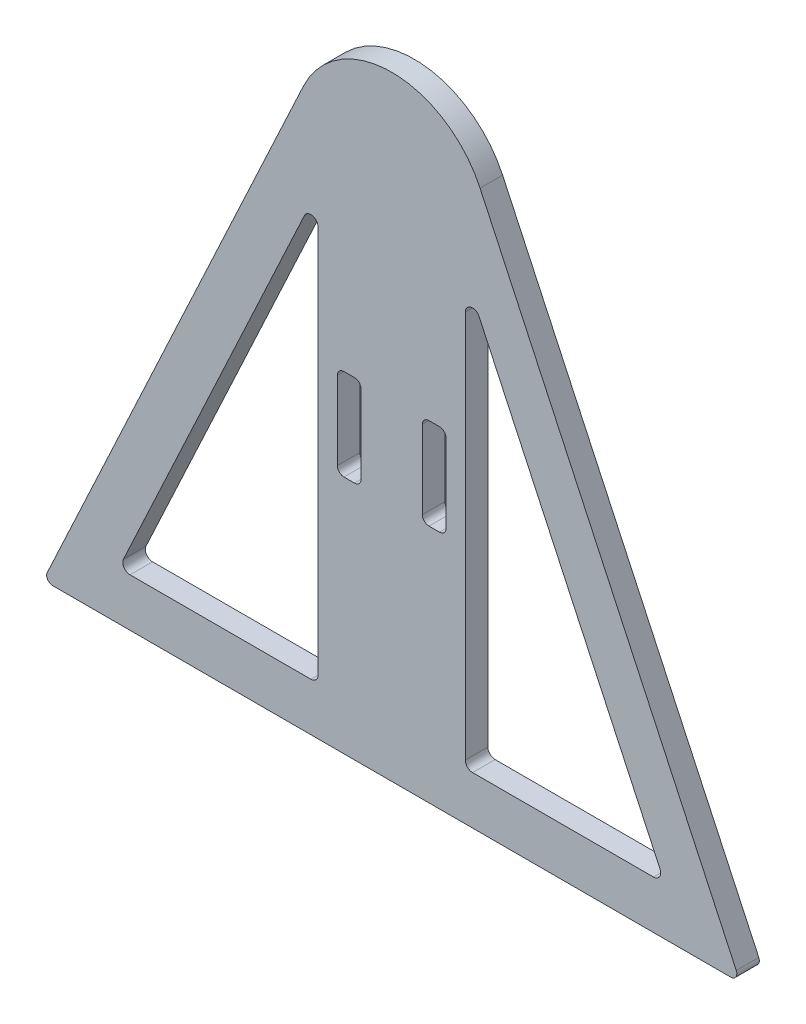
SolidWorks part; units mm, degrees
ref_plane "Front Plane" through (0, 0, 0) normal (0, 0, 1) x (1, 0, 0)
ref_plane "Top Plane" through (0, 0, 0) normal (0, 1, 0) x (1, 0, 0)
ref_plane "Right Plane" through (0, 0, 0) normal (1, 0, 0) x (0, 0, -1)
sketch "Sketch1" plane through (0, 0, 0) normal (0, 0, 1) x (1, 0, 0)
  line L0 (119.9869, 0) -> (-119.9463, 0) construction
  line L1 (73.66, 0) -> (-73.66, 0)
  line L2 (-73.66, 0) -> (-18.6702, 117.926)
  line L3 (0, 278.6164) -> (0, -84.0002) construction
  line L4 (73.66, 0) -> (18.6702, 117.926)
  arc A0 (-18.6702, 117.926) -> (18.6702, 117.926) centre (0, 109.22) cw
  dimension "D1" = 25
  dimension "D2" = 147.32
  dimension "D3" = 109.22
extrude "Extrude1" add sketch "Sketch1" along normal blind 4.7625
sketch "Sketch2" plane through (0, 0, 4.7625) normal (0, 0, 1) x (1, 0, 0)
  line L4 (0, -29.3485) -> (0, 294.747) construction
  line L5 (-11.4935, 52.07) -> (-11.4935, 68.58)
  line L6 (-10.0965, 69.977) -> (-7.874, 69.977)
  line L7 (-7.874, 50.673) -> (-10.0965, 50.673)
  line L8 (6.477, 68.58) -> (6.477, 52.07)
  line L9 (7.874, 50.673) -> (10.0965, 50.673)
  line L10 (10.0965, 69.977) -> (7.874, 69.977)
  line L11 (11.4935, 52.07) -> (11.4935, 68.58)
  line L12 (6.477, 68.58) -> (6.477, 52.07)
  line L13 (7.874, 50.673) -> (10.0965, 50.673)
  line L14 (10.0965, 69.977) -> (7.874, 69.977)
  line L15 (11.4935, 52.07) -> (11.4935, 68.58)
  line L16 (-6.477, 68.58) -> (-6.477, 52.07)
  arc A4 (-11.4935, 68.58) -> (-10.0965, 69.977) centre (-10.0965, 68.58) cw
  arc A5 (-7.874, 69.977) -> (-6.477, 68.58) centre (-7.874, 68.58) cw
  arc A6 (-10.0965, 50.673) -> (-11.4935, 52.07) centre (-10.0965, 52.07) cw
  arc A7 (-6.477, 52.07) -> (-7.874, 50.673) centre (-7.874, 52.07) cw
  arc A8 (6.477, 52.07) -> (7.874, 50.673) centre (7.874, 52.07) ccw
  arc A9 (10.0965, 50.673) -> (11.4935, 52.07) centre (10.0965, 52.07) ccw
  arc A10 (7.874, 69.977) -> (6.477, 68.58) centre (7.874, 68.58) ccw
  arc A11 (11.4935, 68.58) -> (10.0965, 69.977) centre (10.0965, 68.58) ccw
  arc A12 (6.477, 52.07) -> (7.874, 50.673) centre (7.874, 52.07) ccw
  arc A13 (10.0965, 50.673) -> (11.4935, 52.07) centre (10.0965, 52.07) ccw
  arc A14 (7.874, 69.977) -> (6.477, 68.58) centre (7.874, 68.58) ccw
  arc A15 (11.4935, 68.58) -> (10.0965, 69.977) centre (10.0965, 68.58) ccw
  dimension "D1" = 0.127
extrude "Cut-Extrude1" cut sketch "Sketch2" against normal through all
fillet "Fillet1" radius 1.27 2 edges at (-73.66, 0, 2.3813) (73.66, 0, 2.3813)
sketch "Sketch3" plane through (0, 0, 4.7625) normal (0, 0, 1) x (1, 0, 0)
  line L0 (15.5575, 93.6863) -> (15.5575, 11.684)
  line L1 (17.0815, 10.16) -> (55.3198, 10.16)
  line L2 (56.701, 12.3281) -> (18.4627, 94.3304)
  line L3 (0, -28.5694) -> (0, 281.3768) construction
  line L4 (-56.701, 12.3281) -> (-18.4627, 94.3304)
  line L5 (-17.0815, 10.16) -> (-55.3198, 10.16)
  line L6 (-15.5575, 93.6863) -> (-15.5575, 11.684)
  line L7 (11.4935, 52.07) -> (11.4935, 68.58) construction
  line L8 (-71.6665, 0) -> (71.6665, 0) construction
  line L9 (72.8175, 1.8067) -> (18.6702, 117.926) construction
  arc A0 (18.4627, 94.3304) -> (15.5575, 93.6863) centre (17.0815, 93.6863) ccw
  arc A1 (55.3198, 10.16) -> (56.701, 12.3281) centre (55.3198, 11.684) ccw
  arc A2 (17.0815, 10.16) -> (15.5575, 11.684) centre (17.0815, 11.684) cw
  arc A3 (-17.0815, 10.16) -> (-15.5575, 11.684) centre (-17.0815, 11.684) ccw
  arc A4 (-55.3198, 10.16) -> (-56.701, 12.3281) centre (-55.3198, 11.684) cw
  arc A5 (-18.4627, 94.3304) -> (-15.5575, 93.6863) centre (-17.0815, 93.6863) cw
  point P13 (15.5575, 100.5606)
  point P16 (57.712, 10.16)
  point P19 (15.5575, 10.16)
  dimension "D2" = 1.524
  dimension "D1" = 4.064
  dimension "D3" = 10.16
  dimension "D4" = 10.16
extrude "Cut-Extrude2" cut sketch "Sketch3" against normal through all
